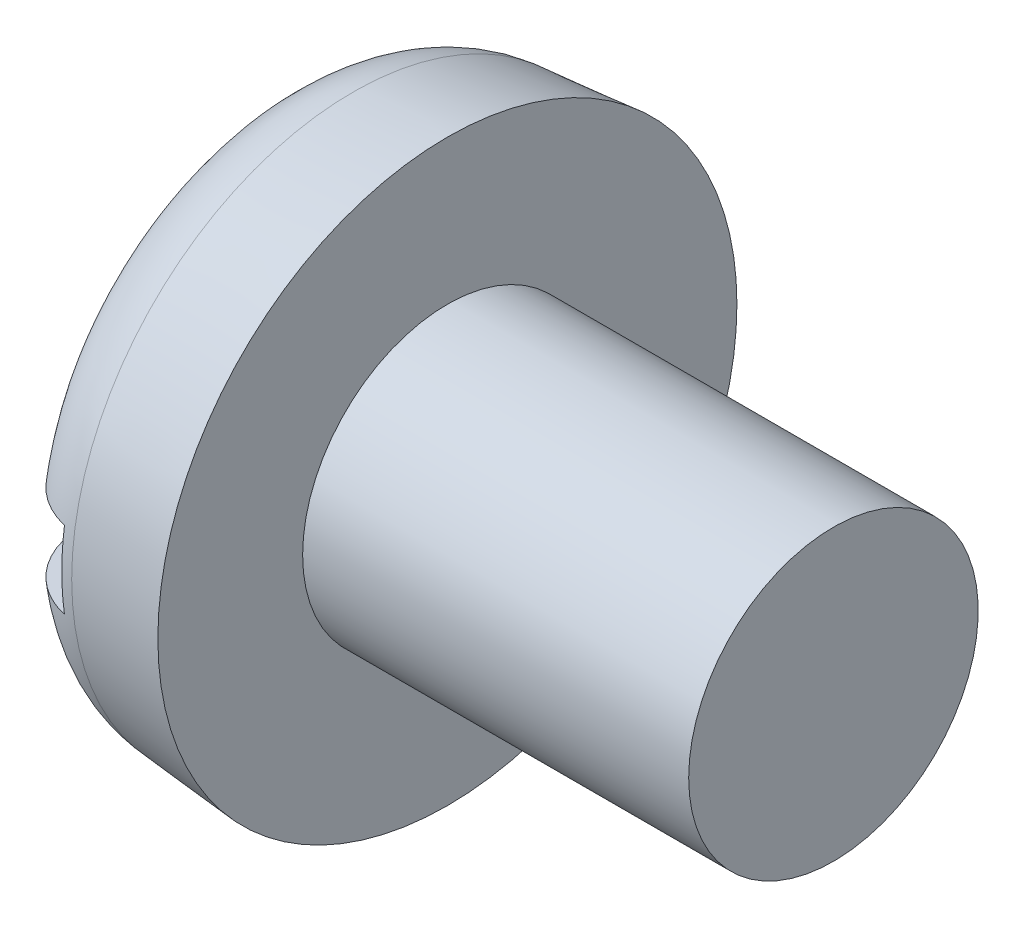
SolidWorks part; units mm, degrees
ref_plane "Plane1" through (0, 0, 0) normal (0, 0, 1) x (1, 0, 0)
ref_plane "Plane2" through (0, 0, 0) normal (0, 1, 0) x (1, 0, 0)
ref_plane "Plane3" through (0, 0, 0) normal (1, 0, 0) x (0, 0, -1)
sketch "BodySke" plane through (0, 0, 0) normal (0, 0, 1) x (1, 0, 0)
  line L0 (3.6, 3) -> (3.6, 6)
  line L1 (0, 0) -> (0, 5.685)
  line L2 (-25.4, 0) -> (127, 0) construction
  line L3 (11.6, 0) -> (0, 0)
  line L4 (3.6, 3) -> (11.6, 3)
  line L5 (11.6, 3) -> (11.6, 0)
  line L6 (0, 5.685) -> (3.6, 6)
  line L9 (4.6, 4.5875) -> (4.6, -4.9375) construction
  line L10 (3.6, 6.35) -> (3.6, -3.175) construction
  dimension "Head_ht" = 3.6
  dimension "Diameter" = 6
  dimension "Length" = 8
  dimension "Head_dia" = 12
  dimension "Advance" = 1
  dimension "Thread_nom" = 8
  dimension "Head_side_angle" = 5
revolve "Base-Revolve" add sketch "BodySke"
fillet "Fillet1" [suppressed] radius 0.25
fillet "Fillet2" radius 1.8 1 edges at (0, 0, 5.685)
sketch "Sketch2" plane through (0, 0, 0) normal (1, 0, 0) x (0, 0, -1)
  line L0 (6, -0.8) -> (-6, -0.8)
  line L1 (6, -0.8) -> (6, 0.8)
  line L2 (-6, 0.8) -> (6, 0.8)
  line L3 (-6, 0.8) -> (-6, -0.8)
  dimension "D1" = 12
  dimension "D2" = 6
  dimension "Slot_width" = 1.6
  dimension "D3" = 0.8
extrude "Slot" cut sketch "Sketch2" along normal blind 1.4
sketch "ThdSchSke" plane through (0, 0, 0) normal (0, 0, 1) x (1, 0, 0)
  line L0 (5.6, -2.4455) -> (5.2117, -3)
  line L1 (5.6, -2.4455) -> (5.9883, -3)
  line L2 (5.9883, -3) -> (5.9883, -3.75)
  line L3 (-3.175, 0) -> (5.1513, 0) construction
  line L5 (5.9883, -3.75) -> (5.2117, -3.75)
  line L6 (5.2117, -3.75) -> (5.2117, -3)
  dimension "Thread_minor" = 4.891
  dimension "Diameter" = 6
  dimension "Start" = 5.6
  dimension "SideAngle" = 55
  dimension "VeeAngle" = 70
  dimension "Overcut" = 7.5
revolve "ThreadSchematic" [suppressed] cut sketch "ThdSchSke" angle 360 about L3
pattern_linear "ThdSchPat" [suppressed]
equation "\"D1@Sketch2\" = \"Head_dia@BodySke\""
equation "\"D2@Sketch2\" = \"D1@Sketch2\" / 2"
equation "\"D3@Sketch2\" = \"Slot_width@Sketch2\" / 2"
equation "\"Thread_length@ThreadCosmetic\" = ((sgn( (\"Length@BodySke\" - \"Advance@BodySke\" * 2.0 ) - \"Thread_nom@BodySke\" )-1)*( (\"Length@BodySke\" - \"Advance@BodySke\"  * 2.0) - \"Thread_nom@BodySke\" ))/-2+ \"Thread_"
equation "\"Thread_minor@ThdSchSke\" = \"Thread_minor@ThreadCosmetic\""
equation "\"Diameter@ThdSchSke\" = \"Diameter@BodySke\""
equation "\"Overcut@ThdSchSke\" = \"Diameter@BodySke\" * 1.25"
equation "\"Start@ThdSchSke\" = \"Head_ht@BodySke\" + \"Length@BodySke\" - \"Thread_length@ThreadCosmetic\"  '---Non-countersunk---"
equation "\"Num_threads@ThdSchPat\" = int( \"Thread_length@ThreadCosmetic\" / \"Advance@BodySke\" + 0.999 )  + 1"
equation "\"Advance@ThdSchPat\" = \"Thread_length@ThreadCosmetic\" /  (\"Num_threads@ThdSchPat\" - 1) 'relax it"
